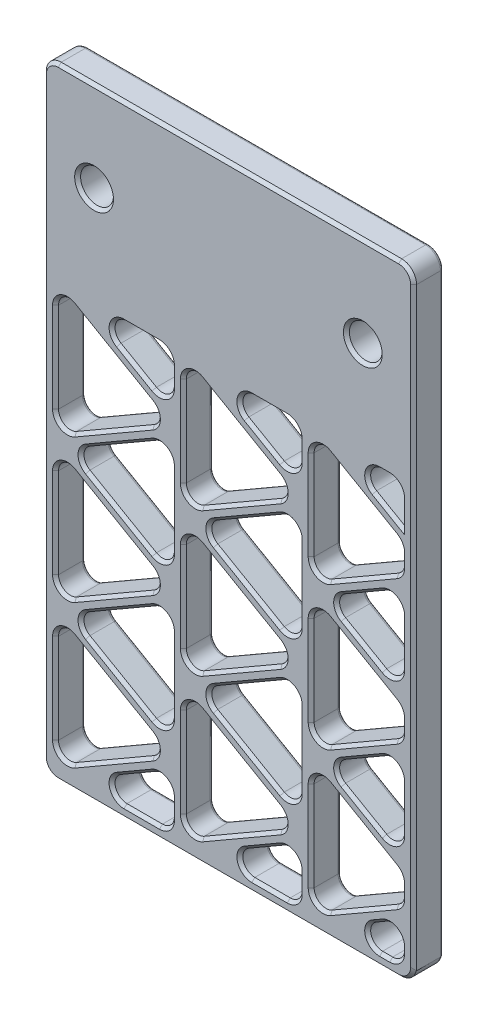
SolidWorks part; units mm, degrees
ref_plane "Płaszczyzna przednia" through (0, 0, 0) normal (0, 0, 1) x (1, 0, 0)
ref_plane "Płaszczyzna górna" through (0, 0, 0) normal (0, 1, 0) x (1, 0, 0)
ref_plane "Płaszczyzna prawa" through (0, 0, 0) normal (1, 0, 0) x (0, 0, -1)
sketch "Szkic1" plane through (0, 0, 0) normal (0, 0, 1) x (1, 0, 0)
  line L1 (0, 0) -> (62, 0)
  line L2 (0, 0) -> (0, 104)
  line L3 (0, 104) -> (62, 104)
  line L4 (62, 0) -> (62, 104)
  dimension "D1" = 62
  dimension "D2" = 104
extrude "Dodanie-wyciągnięcie1" add sketch "Szkic1" along normal blind 5
sketch "Szkic2" plane through (0, 0, 5) normal (0, 0, 1) x (1, 0, 0)
  line L0 (8.5, 89) -> (53.5, 89) construction
  line L1 (31, 89) -> (31, 104) construction
  line L2 (62, 104) -> (0, 104) construction
  dimension "D1" = 45
  dimension "D2" = 15
hole_wizard "Otwór pod śrubę M51" positions "Szkic3" profile "Szkic4" hole size "M5" standard "DIN"
sketch "Szkic3" plane through (0, 0, 5) normal (0, 0, 1) x (1, 0, 0)
  point P0 (8.5, 89)
  point P3 (53.5, 89)
sketch "Szkic4" plane through (8.5, 89, 5) normal (1, 0, 0) x (0, -1, 0)
  line L0 (0, 0) -> (0, 5)
  line L1 (0, 5) -> (2.75, 5)
  line L2 (2.75, 5) -> (2.75, 0)
  line L5 (2.75, 0) -> (0, 0)
  line L11 (0, -6.35) -> (0, 107.95) construction
  dimension "Średnica otworu na wylot" = 5.5
  dimension "Głębokość otworu na wylot" = 5
fillet "Zaokrąglenie1" radius 2.5 4 edges at (62, 0, 2.5) (0, 0, 2.5) (62, 104, 2.5) (0, 104, 2.5)
sketch "Szkic7" plane through (0, 0, 5) normal (0, 0, 1) x (1, 0, 0)
  line L8 (-127.5518, 51.9145) -> (-127.5518, 32.0855)
  line L9 (-88.6374, 71) -> (-108.4663, 71)
  line L10 (-69.5518, 32.0855) -> (-69.5518, 51.9145)
  line L11 (-108.4663, 13) -> (-88.6374, 13)
  line L14 (-125.7, 3.299) -> (-112.9955, 10.634)
  line L15 (-129.45, 14.4636) -> (-129.45, 5.4641)
  line L16 (-113.4955, 12.5) -> (-123.0518, 12.5)
  line L18 (-66.25, 18.5729) -> (-66.25, 31.4271)
  line L19 (-69.0518, 32.7547) -> (-69.0518, 17.5)
  line L24 (-104.3, 3.299) -> (-91.5955, 10.634)
  line L25 (-108.05, 11.5) -> (-108.05, 5.4641)
  line L26 (-92.0955, 12.5) -> (-107.05, 12.5)
  line L30 (-82.9, 3.299) -> (-69.8474, 10.8349)
  line L31 (-86.65, 11.5) -> (-86.65, 5.4641)
  line L32 (-74.0518, 12.5) -> (-85.65, 12.5)
  line L34 (-66.25, 42.5729) -> (-66.25, 55.4271)
  line L35 (-69.0518, 56.7547) -> (-69.0518, 41.2453)
  line L40 (-66.25, 66.5729) -> (-66.25, 70)
  line L41 (-69.0518, 66.5) -> (-69.0518, 65.2453)
  line L42 (-68.75, 72.5) -> (-70.7352, 72.5)
  line L46 (-47.35, 72.5) -> (-53.2859, 72.5)
  line L47 (-44.85, 66.5729) -> (-44.85, 70)
  line L48 (-54.5359, 67.8349) -> (-48.6, 64.4078)
  line L52 (-66.25, 4) -> (-66.25, 7.4271)
  line L53 (-74.6859, 1.5) -> (-68.75, 1.5)
  line L54 (-70, 9.5922) -> (-75.9359, 6.1651)
  line L58 (-25.95, 72.5) -> (-31.8859, 72.5)
  line L59 (-23.45, 66.5729) -> (-23.45, 70)
  line L60 (-33.1359, 67.8349) -> (-27.2, 64.4078)
  line L64 (-44.85, 4) -> (-44.85, 7.4271)
  line L65 (-53.2859, 1.5) -> (-47.35, 1.5)
  line L66 (-48.6, 9.5922) -> (-54.5359, 6.1651)
  line L70 (-48.6, 33.5922) -> (-59.7321, 27.1651)
  line L71 (-44.85, 18.5729) -> (-44.85, 31.4271)
  line L72 (-59.7321, 22.8349) -> (-48.6, 16.4078)
  line L76 (-44.85, 42.5729) -> (-44.85, 55.4271)
  line L77 (-59.7321, 46.8349) -> (-48.6, 40.4078)
  line L78 (-48.6, 57.5922) -> (-59.7321, 51.1651)
  line L82 (-109.05, 4) -> (-109.05, 7.4271)
  line L83 (-117.4859, 1.5) -> (-111.55, 1.5)
  line L84 (-112.8, 9.5922) -> (-118.7359, 6.1651)
  line L88 (-87.65, 4) -> (-87.65, 7.4271)
  line L89 (-96.0859, 1.5) -> (-90.15, 1.5)
  line L90 (-91.4, 9.5922) -> (-97.3359, 6.1651)
  line L94 (-2.05, 4) -> (-2.05, 7.4271)
  line L95 (-10.4859, 1.5) -> (-4.55, 1.5)
  line L96 (-5.8, 9.5922) -> (-11.7359, 6.1651)
  line L100 (-5.8, 33.5922) -> (-16.9321, 27.1651)
  line L101 (-2.05, 18.5729) -> (-2.05, 31.4271)
  line L102 (-16.9321, 22.8349) -> (-5.8, 16.4078)
  line L106 (-2.05, 42.5729) -> (-2.05, 55.4271)
  line L107 (-16.9321, 46.8349) -> (-5.8, 40.4078)
  line L108 (-5.8, 57.5922) -> (-16.9321, 51.1651)
  line L112 (-23.45, 42.5729) -> (-23.45, 55.4271)
  line L113 (-38.3321, 46.8349) -> (-27.2, 40.4078)
  line L114 (-27.2, 57.5922) -> (-38.3321, 51.1651)
  line L118 (-27.2, 33.5922) -> (-38.3321, 27.1651)
  line L119 (-23.45, 18.5729) -> (-23.45, 31.4271)
  line L120 (-38.3321, 22.8349) -> (-27.2, 16.4078)
  line L124 (-23.45, 4) -> (-23.45, 7.4271)
  line L125 (-31.8859, 1.5) -> (-25.95, 1.5)
  line L126 (-27.2, 9.5922) -> (-33.1359, 6.1651)
  line L130 (-4.55, 72.5) -> (-10.4859, 72.5)
  line L131 (-2.05, 66.5729) -> (-2.05, 70)
  line L132 (-11.7359, 67.8349) -> (-5.8, 64.4078)
  line L136 (-18.7, 27.299) -> (-5.6474, 34.8349)
  line L137 (-22.45, 44.5359) -> (-22.45, 29.4641)
  line L138 (-5.6474, 39.1651) -> (-18.7, 46.701)
  line L142 (-18.7, 51.299) -> (-5.6474, 58.8349)
  line L143 (-22.45, 68.5359) -> (-22.45, 53.4641)
  line L144 (-5.6474, 63.1651) -> (-18.7, 70.701)
  line L148 (-40.1, 3.299) -> (-27.0474, 10.8349)
  line L149 (-43.85, 20.5359) -> (-43.85, 5.4641)
  line L150 (-27.0474, 15.1651) -> (-40.1, 22.701)
  line L154 (-40.1, 27.299) -> (-27.0474, 34.8349)
  line L155 (-43.85, 44.5359) -> (-43.85, 29.4641)
  line L156 (-27.0474, 39.1651) -> (-40.1, 46.701)
  line L160 (-61.5, 51.299) -> (-48.4474, 58.8349)
  line L161 (-65.25, 68.5359) -> (-65.25, 53.4641)
  line L162 (-48.4474, 63.1651) -> (-61.5, 70.701)
  line L166 (-61.5, 27.299) -> (-48.4474, 34.8349)
  line L167 (-65.25, 44.5359) -> (-65.25, 29.4641)
  line L168 (-48.4474, 39.1651) -> (-61.5, 46.701)
  line L172 (-61.5, 3.299) -> (-48.4474, 10.8349)
  line L173 (-65.25, 20.5359) -> (-65.25, 5.4641)
  line L174 (-48.4474, 15.1651) -> (-61.5, 22.701)
  line L178 (-40.1, 51.299) -> (-27.0474, 58.8349)
  line L179 (-43.85, 68.5359) -> (-43.85, 53.4641)
  line L180 (-27.0474, 63.1651) -> (-40.1, 70.701)
  line L184 (-18.7, 3.299) -> (-5.6474, 10.8349)
  line L185 (-22.45, 20.5359) -> (-22.45, 5.4641)
  line L186 (-5.6474, 15.1651) -> (-18.7, 22.701)
  line L196 (-38.15, 109.8431) -> (-30.95, 105.6862)
  line L197 (-38.15, 118.1569) -> (-38.15, 109.8431)
  line L198 (-30.95, 122.3138) -> (-38.15, 118.1569)
  line L199 (-23.75, 118.1569) -> (-30.95, 122.3138)
  line L200 (-23.75, 109.8431) -> (-23.75, 118.1569)
  line L201 (-30.95, 105.6862) -> (-23.75, 109.8431)
  circle A2 centre (-123.5518, 67) radius 2.75
  circle A4 centre (-73.5518, 67) radius 2.75
  circle A6 centre (-123.5518, 17) radius 2.75
  circle A8 centre (-73.5518, 17) radius 2.75
  arc A28 (-129.45, 5.4641) -> (-125.7, 3.299) centre (-126.95, 5.4641) ccw
  arc A29 (-127.6063, 15.0004) -> (-129.45, 14.4636) centre (-128.45, 14.4636) ccw
  arc A30 (-127.6063, 15.0004) -> (-123.0518, 12.5) centre (-123.0518, 17.8982) ccw
  arc A31 (-112.9955, 10.634) -> (-113.4955, 12.5) centre (-113.4955, 11.5) ccw
  arc A32 (-127.4945, 52.2482) -> (-127.5518, 51.9145) centre (-126.5518, 51.9145) ccw
  arc A33 (-108.8001, 70.9427) -> (-127.4945, 52.2482) centre (-98.5518, 42) ccw
  arc A34 (-108.4663, 71) -> (-108.8001, 70.9427) centre (-108.4663, 70) ccw
  arc A35 (-88.3036, 70.9427) -> (-88.6374, 71) centre (-88.6374, 70) ccw
  arc A36 (-69.6092, 52.2482) -> (-88.3036, 70.9427) centre (-98.5518, 42) ccw
  arc A37 (-69.5518, 51.9145) -> (-69.6092, 52.2482) centre (-70.5518, 51.9145) ccw
  arc A38 (-69.6092, 31.7518) -> (-69.5518, 32.0855) centre (-70.5518, 32.0855) ccw
  arc A39 (-88.3036, 13.0573) -> (-69.6092, 31.7518) centre (-98.5518, 42) ccw
  arc A40 (-88.6374, 13) -> (-88.3036, 13.0573) centre (-88.6374, 14) ccw
  arc A41 (-108.8001, 13.0573) -> (-108.4663, 13) centre (-108.4663, 14) ccw
  arc A42 (-127.4945, 31.7518) -> (-108.8001, 13.0573) centre (-98.5518, 42) ccw
  arc A43 (-127.5518, 32.0855) -> (-127.4945, 31.7518) centre (-126.5518, 32.0855) ccw
  arc A50 (-66.25, 31.4271) -> (-67.5864, 33.6398) centre (-68.75, 31.4271) ccw
  arc A51 (-67.5956, 16.3554) -> (-66.25, 18.5729) centre (-68.75, 18.5729) ccw
  arc A52 (-69.0564, 17.2853) -> (-67.5956, 16.3554) centre (-68.0574, 17.2424) ccw
  arc A53 (-69.0564, 17.2853) -> (-69.0518, 17.5) centre (-74.0518, 17.5) ccw
  arc A54 (-67.5864, 33.6398) -> (-69.0518, 32.7547) centre (-68.0518, 32.7547) ccw
  arc A56 (-108.05, 5.4641) -> (-104.3, 3.299) centre (-105.55, 5.4641) ccw
  arc A57 (-107.05, 12.5) -> (-108.05, 11.5) centre (-107.05, 11.5) ccw
  arc A58 (-91.5955, 10.634) -> (-92.0955, 12.5) centre (-92.0955, 11.5) ccw
  arc A66 (-86.65, 5.4641) -> (-82.9, 3.299) centre (-84.15, 5.4641) ccw
  arc A67 (-85.65, 12.5) -> (-86.65, 11.5) centre (-85.65, 11.5) ccw
  arc A68 (-74.0518, 12.5) -> (-70.3889, 14.0967) centre (-74.0518, 17.5) ccw
  arc A69 (-68.6955, 13.6933) -> (-70.3889, 14.0967) centre (-69.6563, 13.416) ccw
  arc A70 (-69.8474, 10.8349) -> (-68.6955, 13.6933) centre (-71.0974, 13) ccw
  arc A74 (-66.25, 55.4271) -> (-67.5864, 57.6398) centre (-68.75, 55.4271) ccw
  arc A75 (-67.5864, 40.3602) -> (-66.25, 42.5729) centre (-68.75, 42.5729) ccw
  arc A76 (-69.0518, 41.2453) -> (-67.5864, 40.3602) centre (-68.0518, 41.2453) ccw
  arc A77 (-67.5864, 57.6398) -> (-69.0518, 56.7547) centre (-68.0518, 56.7547) ccw
  arc A84 (-66.25, 70) -> (-68.75, 72.5) centre (-68.75, 70) ccw
  arc A85 (-67.5864, 64.3602) -> (-66.25, 66.5729) centre (-68.75, 66.5729) ccw
  arc A86 (-69.0518, 65.2453) -> (-67.5864, 64.3602) centre (-68.0518, 65.2453) ccw
  arc A87 (-69.0518, 66.5) -> (-71.288, 70.6667) centre (-74.0518, 66.5) ccw
  arc A88 (-70.7352, 72.5) -> (-71.288, 70.6667) centre (-70.7352, 71.5) ccw
  arc A90 (-44.85, 70) -> (-47.35, 72.5) centre (-47.35, 70) ccw
  arc A91 (-48.6, 64.4078) -> (-44.85, 66.5729) centre (-47.35, 66.5729) ccw
  arc A92 (-53.2859, 72.5) -> (-54.5359, 67.8349) centre (-53.2859, 70) ccw
  arc A96 (-68.75, 1.5) -> (-66.25, 4) centre (-68.75, 4) ccw
  arc A97 (-75.9359, 6.1651) -> (-74.6859, 1.5) centre (-74.6859, 4) ccw
  arc A98 (-66.25, 7.4271) -> (-70, 9.5922) centre (-68.75, 7.4271) ccw
  arc A102 (-23.45, 70) -> (-25.95, 72.5) centre (-25.95, 70) ccw
  arc A103 (-27.2, 64.4078) -> (-23.45, 66.5729) centre (-25.95, 66.5729) ccw
  arc A104 (-31.8859, 72.5) -> (-33.1359, 67.8349) centre (-31.8859, 70) ccw
  arc A108 (-47.35, 1.5) -> (-44.85, 4) centre (-47.35, 4) ccw
  arc A109 (-54.5359, 6.1651) -> (-53.2859, 1.5) centre (-53.2859, 4) ccw
  arc A110 (-44.85, 7.4271) -> (-48.6, 9.5922) centre (-47.35, 7.4271) ccw
  arc A114 (-44.85, 31.4271) -> (-48.6, 33.5922) centre (-47.35, 31.4271) ccw
  arc A115 (-48.6, 16.4078) -> (-44.85, 18.5729) centre (-47.35, 18.5729) ccw
  arc A116 (-59.7321, 27.1651) -> (-59.7321, 22.8349) centre (-58.4821, 25) ccw
  arc A120 (-48.6, 40.4078) -> (-44.85, 42.5729) centre (-47.35, 42.5729) ccw
  arc A121 (-59.7321, 51.1651) -> (-59.7321, 46.8349) centre (-58.4821, 49) ccw
  arc A122 (-44.85, 55.4271) -> (-48.6, 57.5922) centre (-47.35, 55.4271) ccw
  arc A126 (-111.55, 1.5) -> (-109.05, 4) centre (-111.55, 4) ccw
  arc A127 (-118.7359, 6.1651) -> (-117.4859, 1.5) centre (-117.4859, 4) ccw
  arc A128 (-109.05, 7.4271) -> (-112.8, 9.5922) centre (-111.55, 7.4271) ccw
  arc A132 (-90.15, 1.5) -> (-87.65, 4) centre (-90.15, 4) ccw
  arc A133 (-97.3359, 6.1651) -> (-96.0859, 1.5) centre (-96.0859, 4) ccw
  arc A134 (-87.65, 7.4271) -> (-91.4, 9.5922) centre (-90.15, 7.4271) ccw
  arc A138 (-4.55, 1.5) -> (-2.05, 4) centre (-4.55, 4) ccw
  arc A139 (-11.7359, 6.1651) -> (-10.4859, 1.5) centre (-10.4859, 4) ccw
  arc A140 (-2.05, 7.4271) -> (-5.8, 9.5922) centre (-4.55, 7.4271) ccw
  arc A144 (-2.05, 31.4271) -> (-5.8, 33.5922) centre (-4.55, 31.4271) ccw
  arc A145 (-5.8, 16.4078) -> (-2.05, 18.5729) centre (-4.55, 18.5729) ccw
  arc A146 (-16.9321, 27.1651) -> (-16.9321, 22.8349) centre (-15.6821, 25) ccw
  arc A150 (-5.8, 40.4078) -> (-2.05, 42.5729) centre (-4.55, 42.5729) ccw
  arc A151 (-16.9321, 51.1651) -> (-16.9321, 46.8349) centre (-15.6821, 49) ccw
  arc A152 (-2.05, 55.4271) -> (-5.8, 57.5922) centre (-4.55, 55.4271) ccw
  arc A156 (-27.2, 40.4078) -> (-23.45, 42.5729) centre (-25.95, 42.5729) ccw
  arc A157 (-38.3321, 51.1651) -> (-38.3321, 46.8349) centre (-37.0821, 49) ccw
  arc A158 (-23.45, 55.4271) -> (-27.2, 57.5922) centre (-25.95, 55.4271) ccw
  arc A162 (-23.45, 31.4271) -> (-27.2, 33.5922) centre (-25.95, 31.4271) ccw
  arc A163 (-27.2, 16.4078) -> (-23.45, 18.5729) centre (-25.95, 18.5729) ccw
  arc A164 (-38.3321, 27.1651) -> (-38.3321, 22.8349) centre (-37.0821, 25) ccw
  arc A168 (-25.95, 1.5) -> (-23.45, 4) centre (-25.95, 4) ccw
  arc A169 (-33.1359, 6.1651) -> (-31.8859, 1.5) centre (-31.8859, 4) ccw
  arc A170 (-23.45, 7.4271) -> (-27.2, 9.5922) centre (-25.95, 7.4271) ccw
  arc A174 (-2.05, 70) -> (-4.55, 72.5) centre (-4.55, 70) ccw
  arc A175 (-5.8, 64.4078) -> (-2.05, 66.5729) centre (-4.55, 66.5729) ccw
  arc A176 (-10.4859, 72.5) -> (-11.7359, 67.8349) centre (-10.4859, 70) ccw
  arc A180 (-22.45, 29.4641) -> (-18.7, 27.299) centre (-19.95, 29.4641) ccw
  arc A181 (-18.7, 46.701) -> (-22.45, 44.5359) centre (-19.95, 44.5359) ccw
  arc A182 (-5.6474, 34.8349) -> (-5.6474, 39.1651) centre (-6.8974, 37) ccw
  arc A186 (-22.45, 53.4641) -> (-18.7, 51.299) centre (-19.95, 53.4641) ccw
  arc A187 (-18.7, 70.701) -> (-22.45, 68.5359) centre (-19.95, 68.5359) ccw
  arc A188 (-5.6474, 58.8349) -> (-5.6474, 63.1651) centre (-6.8974, 61) ccw
  arc A192 (-43.85, 5.4641) -> (-40.1, 3.299) centre (-41.35, 5.4641) ccw
  arc A193 (-40.1, 22.701) -> (-43.85, 20.5359) centre (-41.35, 20.5359) ccw
  arc A194 (-27.0474, 10.8349) -> (-27.0474, 15.1651) centre (-28.2974, 13) ccw
  arc A198 (-43.85, 29.4641) -> (-40.1, 27.299) centre (-41.35, 29.4641) ccw
  arc A199 (-40.1, 46.701) -> (-43.85, 44.5359) centre (-41.35, 44.5359) ccw
  arc A200 (-27.0474, 34.8349) -> (-27.0474, 39.1651) centre (-28.2974, 37) ccw
  arc A204 (-65.25, 53.4641) -> (-61.5, 51.299) centre (-62.75, 53.4641) ccw
  arc A205 (-61.5, 70.701) -> (-65.25, 68.5359) centre (-62.75, 68.5359) ccw
  arc A206 (-48.4474, 58.8349) -> (-48.4474, 63.1651) centre (-49.6974, 61) ccw
  arc A210 (-65.25, 29.4641) -> (-61.5, 27.299) centre (-62.75, 29.4641) ccw
  arc A211 (-61.5, 46.701) -> (-65.25, 44.5359) centre (-62.75, 44.5359) ccw
  arc A212 (-48.4474, 34.8349) -> (-48.4474, 39.1651) centre (-49.6974, 37) ccw
  arc A216 (-65.25, 5.4641) -> (-61.5, 3.299) centre (-62.75, 5.4641) ccw
  arc A217 (-61.5, 22.701) -> (-65.25, 20.5359) centre (-62.75, 20.5359) ccw
  arc A218 (-48.4474, 10.8349) -> (-48.4474, 15.1651) centre (-49.6974, 13) ccw
  arc A222 (-43.85, 53.4641) -> (-40.1, 51.299) centre (-41.35, 53.4641) ccw
  arc A223 (-40.1, 70.701) -> (-43.85, 68.5359) centre (-41.35, 68.5359) ccw
  arc A224 (-27.0474, 58.8349) -> (-27.0474, 63.1651) centre (-28.2974, 61) ccw
  circle A227 centre (-120.95, 89) radius 3.2
  arc A228 (-22.45, 5.4641) -> (-18.7, 3.299) centre (-19.95, 5.4641) ccw
  arc A229 (-18.7, 22.701) -> (-22.45, 20.5359) centre (-19.95, 20.5359) ccw
  arc A230 (-5.6474, 10.8349) -> (-5.6474, 15.1651) centre (-6.8974, 13) ccw
  circle A232 centre (-50.95, 89) radius 3.25
  circle A234 centre (-10.95, 89) radius 3.25
sketch "Szkic8" plane through (0, 0, 5) normal (0, 0, 1) x (1, 0, 0)
  line L0 (-17.95, 72) -> (-2.55, 72) construction
  line L1 (-2.55, 72) -> (-2.55, 63.1088) construction
  line L2 (-2.55, 63.1088) -> (-17.95, 72) construction
  line L3 (-4.55, 72.5) -> (-10.4859, 72.5) construction
  line L4 (-2.05, 66.5729) -> (-2.05, 70) construction
  line L5 (-11.7359, 67.8349) -> (-5.8, 64.4078) construction
  line L6 (-21.95, 72) -> (-21.95, 50) construction
  line L7 (-21.95, 50) -> (-2.8974, 61) construction
  line L8 (-2.8974, 61) -> (-21.95, 72) construction
  line L9 (-2.55, 58.8912) -> (-19.6821, 49) construction
  line L10 (-19.6821, 49) -> (-2.55, 39.1088) construction
  line L11 (-2.55, 39.1088) -> (-2.55, 58.8912) construction
  line L12 (-21.95, 48) -> (-21.95, 26) construction
  line L13 (-21.95, 26) -> (-2.8974, 37) construction
  line L14 (-2.8974, 37) -> (-21.95, 48) construction
  line L15 (-19.6821, 25) -> (-2.55, 34.8912) construction
  line L16 (-2.55, 34.8912) -> (-2.55, 15.1088) construction
  line L17 (-2.55, 15.1088) -> (-19.6821, 25) construction
  line L18 (-21.95, 24) -> (-21.95, 2) construction
  line L19 (-21.95, 2) -> (-2.8974, 13) construction
  line L20 (-2.8974, 13) -> (-21.95, 24) construction
  line L21 (-2.55, 10.8912) -> (-17.95, 2) construction
  line L22 (-17.95, 2) -> (-2.55, 2) construction
  line L23 (-2.55, 2) -> (-2.55, 10.8912) construction
  line L24 (-5.6474, 63.1651) -> (-18.7, 70.701) construction
  line L25 (-18.7, 51.299) -> (-5.6474, 58.8349) construction
  line L26 (-22.45, 68.5359) -> (-22.45, 53.4641) construction
  line L28 (-2.05, 42.5729) -> (-2.05, 55.4271) construction
  line L29 (-5.8, 57.5922) -> (-16.9321, 51.1651) construction
  line L30 (-16.9321, 46.8349) -> (-5.8, 40.4078) construction
  line L31 (-5.6474, 39.1651) -> (-18.7, 46.701) construction
  line L32 (-22.45, 44.5359) -> (-22.45, 29.4641) construction
  line L33 (-18.7, 27.299) -> (-5.6474, 34.8349) construction
  line L34 (-2.05, 18.5729) -> (-2.05, 31.4271) construction
  line L35 (-16.9321, 22.8349) -> (-5.8, 16.4078) construction
  line L36 (-5.6474, 15.1651) -> (-18.7, 22.701) construction
  line L37 (-18.7, 3.299) -> (-5.6474, 10.8349) construction
  line L38 (-5.8, 9.5922) -> (-11.7359, 6.1651) construction
  line L39 (-2.05, 4) -> (-2.05, 7.4271) construction
  line L40 (-10.4859, 1.5) -> (-4.55, 1.5) construction
  line L41 (-5.8, 33.5922) -> (-16.9321, 27.1651) construction
  line L42 (-22.45, 20.5359) -> (-22.45, 5.4641) construction
  line L43 (6.05, 72) -> (21.45, 72)
  line L44 (21.45, 72) -> (21.45, 63.1088)
  line L45 (21.45, 63.1088) -> (6.05, 72)
  line L46 (2.05, 72) -> (2.05, 50)
  line L47 (2.05, 50) -> (21.1026, 61)
  line L48 (21.1026, 61) -> (2.05, 72)
  line L49 (21.45, 58.8912) -> (4.3179, 49)
  line L50 (4.3179, 49) -> (21.45, 39.1088)
  line L51 (21.45, 39.1088) -> (21.45, 58.8912)
  line L52 (2.05, 48) -> (2.05, 26)
  line L53 (2.05, 26) -> (21.1026, 37)
  line L54 (21.1026, 37) -> (2.05, 48)
  line L55 (4.3179, 25) -> (21.45, 34.8912)
  line L56 (21.45, 34.8912) -> (21.45, 15.1088)
  line L57 (21.45, 15.1088) -> (4.3179, 25)
  line L58 (2.05, 24) -> (2.05, 2)
  line L59 (2.05, 2) -> (21.1026, 13)
  line L60 (21.1026, 13) -> (2.05, 24)
  line L61 (21.45, 10.8912) -> (6.05, 2)
  line L62 (6.05, 2) -> (21.45, 2)
  line L63 (21.45, 2) -> (21.45, 10.8912)
  line L64 (27.45, 72) -> (42.85, 72)
  line L65 (42.85, 72) -> (42.85, 63.1088)
  line L66 (42.85, 63.1088) -> (27.45, 72)
  line L67 (23.45, 72) -> (23.45, 50)
  line L68 (23.45, 50) -> (42.5026, 61)
  line L69 (42.5026, 61) -> (23.45, 72)
  line L70 (42.85, 58.8912) -> (25.7179, 49)
  line L71 (25.7179, 49) -> (42.85, 39.1088)
  line L72 (42.85, 39.1088) -> (42.85, 58.8912)
  line L73 (23.45, 48) -> (23.45, 26)
  line L74 (23.45, 26) -> (42.5026, 37)
  line L75 (42.5026, 37) -> (23.45, 48)
  line L76 (25.7179, 25) -> (42.85, 34.8912)
  line L77 (42.85, 34.8912) -> (42.85, 15.1088)
  line L78 (42.85, 15.1088) -> (25.7179, 25)
  line L79 (23.45, 24) -> (23.45, 2)
  line L80 (23.45, 2) -> (42.5026, 13)
  line L81 (42.5026, 13) -> (23.45, 24)
  line L82 (42.85, 10.8912) -> (27.45, 2)
  line L83 (27.45, 2) -> (42.85, 2)
  line L84 (42.85, 2) -> (42.85, 10.8912)
  line L85 (48.85, 72) -> (64.25, 72)
  line L86 (64.25, 72) -> (64.25, 63.1088)
  line L87 (64.25, 63.1088) -> (48.85, 72)
  line L88 (44.85, 72) -> (44.85, 50)
  line L89 (44.85, 50) -> (63.9026, 61)
  line L90 (63.9026, 61) -> (44.85, 72)
  line L91 (64.25, 58.8912) -> (47.1179, 49)
  line L92 (47.1179, 49) -> (64.25, 39.1088)
  line L93 (64.25, 39.1088) -> (64.25, 58.8912)
  line L94 (44.85, 48) -> (44.85, 26)
  line L95 (44.85, 26) -> (63.9026, 37)
  line L96 (63.9026, 37) -> (44.85, 48)
  line L97 (47.1179, 25) -> (64.25, 34.8912)
  line L98 (64.25, 34.8912) -> (64.25, 15.1088)
  line L99 (64.25, 15.1088) -> (47.1179, 25)
  line L100 (44.85, 24) -> (44.85, 2)
  line L101 (44.85, 2) -> (63.9026, 13)
  line L102 (63.9026, 13) -> (44.85, 24)
  line L103 (64.25, 10.8912) -> (48.85, 2)
  line L104 (48.85, 2) -> (64.25, 2)
  line L105 (64.25, 2) -> (64.25, 10.8912)
  dimension "D1" = 0.5
  dimension "D2" = 0.5
  dimension "D3" = 0.5
  dimension "D4" = 0.5
  dimension "D5" = 0.5
  dimension "D6" = 0.5
  dimension "D7" = 0.5
  dimension "D8" = 0.5
  dimension "D9" = 0.5
  dimension "D10" = 0.5
  dimension "D11" = 0.5
  dimension "D12" = 0.5
  dimension "D13" = 0.5
  dimension "D14" = 0.5
  dimension "D15" = 0.5
  dimension "D16" = 0.5
  dimension "D17" = 0.5
  dimension "D18" = 0.5
  dimension "D19" = 0.5
  dimension "D20" = 0.5
  dimension "D21" = 0.5
  dimension "D22" = 2
  dimension "D23" = 3
extrude "Wytnij-wyciągnięcie1" cut sketch "Szkic8" against normal through all
sketch "Szkic9" plane through (0, 0, 5) normal (0, 0, 1) x (1, 0, 0)
  line L0 (48.85, 2) -> (61.9495, 2) construction
  line L1 (62, 72) -> (60, 72)
  line L2 (62, 72) -> (62, 2)
  line L3 (62, 2) -> (60, 2)
  line L4 (60, 72) -> (60, 2)
  dimension "D1" = 2
extrude "Dodanie-wyciągnięcie4" add sketch "Szkic9" against normal blind 5
fillet "Zaokrąglenie2" radius 2 13 edges at (60, 8.4375, 2.5) (21.45, 10.8912, 2.5) (42.85, 10.8912, 2.5) (60, 32.4375, 2.5) (60, 39.2531, 2.5) (42.85, 34.8912, 2.5) (21.45, 34.8912, 2.5) (21.45, 58.8912, 2.5) (42.85, 58.8912, 2.5) (60, 56.4375, 2.5) (60, 72, 2.5) (42.85, 72, 2.5) (21.45, 72, 2.5)
fillet "Zaokrąglenie3" radius 2 9 edges at (2.05, 24, 2.5) (44.85, 24, 2.5) (23.45, 24, 2.5) (44.85, 48, 2.5) (23.45, 48, 2.5) (2.05, 48, 2.5) (44.85, 72, 2.5) (23.45, 72, 2.5) (2.05, 72, 2.5)
fillet "Zaokrąglenie4" radius 2 22 edges at (21.45, 15.1088, 2.5) (21.45, 39.1088, 2.5) (42.85, 39.1088, 2.5) (42.85, 15.1088, 2.5) (60, 17.5625, 2.5) (60, 41.5625, 2.5) (42.85, 63.1088, 2.5) (21.45, 63.1088, 2.5) (21.45, 2, 2.5) (42.85, 2, 2.5) (60, 2, 2.5) (21.1026, 61, 2.5) (42.5026, 61, 2.5) (60, 34.7469, 2.5) (60, 58.7469, 2.5) (42.5026, 37, 2.5) (21.1026, 37, 2.5) (21.1026, 13, 2.5) (42.5026, 13, 2.5) (60, 10.7469, 2.5) (60, 15.2531, 2.5) (60, 63.2531, 2.5)
fillet "Zaokrąglenie5" radius 2 21 edges at (6.05, 2, 2.5) (27.45, 2, 2.5) (48.85, 2, 2.5) (44.85, 2, 2.5) (23.45, 2, 2.5) (2.05, 2, 2.5) (23.45, 26, 2.5) (44.85, 26, 2.5) (2.05, 26, 2.5) (2.05, 50, 2.5) (23.45, 50, 2.5) (44.85, 50, 2.5) (4.3179, 25, 2.5) (47.1179, 25, 2.5) (25.7179, 25, 2.5) (4.3179, 49, 2.5) (25.7179, 49, 2.5) (47.1179, 49, 2.5) (48.85, 72, 2.5) (27.45, 72, 2.5) (6.05, 72, 2.5)
fillet "Zaokrąglenie6" radius 0.5 142 edges at (11.5763, 66.5, 0) (19.1026, 61, 0) (11.5763, 55.5, 0) (3.05, 51.7321, 0) (2.05, 61, 0) (3.05, 70.2679, 0) (56.25, 89, 0) (11.25, 89, 0) (20.8642, 71.4142, 0) (21.45, 68.2865, 0) (20.45, 64.8409, 0) (15.4821, 66.5544, 0) (11.5822, 70.5176, 0) (16.4821, 72, 0) (42.2642, 71.4142, 0) (42.85, 68.2865, 0) (41.85, 64.8409, 0) (36.8821, 66.5544, 0) (32.9822, 70.5176, 0) (37.8821, 72, 0) (24.45, 70.2679, 0) (32.9763, 66.5, 0) (40.5026, 61, 0) (32.9763, 55.5, 0) (24.45, 51.7321, 0) (23.45, 61, 0) (3.05, 22.2679, 0) (11.5763, 18.5, 0) (19.1026, 13, 0) (11.5763, 7.5, 0) (3.05, 3.7321, 0) (2.05, 13, 0) (20.45, 9.1591, 0) (21.45, 5.7135, 0) (20.8642, 2.5858, 0) (16.4821, 2, 0) (11.5822, 3.4824, 0) (15.4821, 7.4456, 0) (20.45, 57.1591, 0) (21.45, 49, 0) (20.45, 40.8409, 0) (12.884, 44.0544, 0) (6.3179, 49, 0) (12.884, 53.9456, 0) (20.45, 33.1591, 0) (21.45, 25, 0) (20.45, 16.8409, 0) (12.884, 20.0544, 0) (6.3179, 25, 0) (12.884, 29.9456, 0) (3.05, 46.2679, 0) (11.5763, 42.5, 0) (19.1026, 37, 0) (11.5763, 31.5, 0) (3.05, 27.7321, 0) (2.05, 37, 0) (41.85, 9.1591, 0) (42.85, 5.7135, 0) (42.2642, 2.5858, 0) (37.8821, 2, 0) (32.9822, 3.4824, 0) (36.8821, 7.4456, 0) (24.45, 46.2679, 0) (32.9763, 42.5, 0) (40.5026, 37, 0) (32.9763, 31.5, 0) (24.45, 27.7321, 0) (23.45, 37, 0) (41.85, 57.1591, 0) (42.85, 49, 0) (41.85, 40.8409, 0) (34.284, 44.0544, 0) (27.7179, 49, 0) (34.284, 53.9456, 0) (24.45, 22.2679, 0) (32.9763, 18.5, 0) (40.5026, 13, 0) (32.9763, 7.5, 0) (24.45, 3.7321, 0) (23.45, 13, 0) (41.85, 33.1591, 0) (42.85, 25, 0) (41.85, 16.8409, 0) (34.284, 20.0544, 0) (27.7179, 25, 0) (34.284, 29.9456, 0) (61.2678, 103.2678, 0) (31, 104, 0) (0.7322, 103.2678, 0) (0, 52, 0) (0.7322, 0.7322, 0) (31, 0, 0) (61.0811, 0.5635, 0) (61.9747, 2, 0) (62, 51.75, 0) (59.4142, 2.5858, 0) (57.1571, 2, 0) (54.3822, 3.4824, 0) (56.1571, 6.2187, 0) (59, 6.7054, 0) (60, 4.4867, 0) (59.4142, 71.4142, 0) (60, 67.7813, 0) (57.6571, 66.9152, 0) (54.3822, 70.5176, 0) (57.1571, 72, 0) (45.85, 70.2679, 0) (53.425, 67.0492, 0) (59.7321, 63.0984, 0) (60, 61, 0) (59.7321, 58.9016, 0) (53.425, 54.9508, 0) (45.85, 51.7321, 0) (44.85, 61, 0) (59, 54.7054, 0) (60, 49, 0) (59, 43.2946, 0) (53.559, 45.2813, 0) (49.1179, 49, 0) (53.559, 52.7187, 0) (45.85, 46.2679, 0) (53.425, 43.0492, 0) (59.7321, 39.0984, 0) (60, 37, 0) (59.7321, 34.9016, 0) (53.425, 30.9508, 0) (45.85, 27.7321, 0) (44.85, 37, 0) (59, 30.7054, 0) (60, 25, 0) (59, 19.2946, 0) (53.559, 21.2813, 0) (49.1179, 25, 0) (53.559, 28.7187, 0) (45.85, 22.2679, 0) (53.425, 19.0492, 0) (59.7321, 15.0984, 0) (60, 13, 0) (59.7321, 10.9016, 0) (53.425, 6.9508, 0) (45.85, 3.7321, 0) (44.85, 13, 0)
chamfer "Sfazowanie1" distance 0.5 angle 45 142 edges at (61.0811, 0.5635, 5) (31, 0, 5) (0.7322, 0.7322, 5) (0, 52, 5) (0.7322, 103.2678, 5) (31, 104, 5) (61.2678, 103.2678, 5) (62, 51.75, 5) (61.9747, 2, 5) (56.25, 89, 5) (11.25, 89, 5) (20.8642, 71.4142, 5) (16.4821, 72, 5) (11.5822, 70.5176, 5) (15.4821, 66.5544, 5) (20.45, 64.8409, 5) (21.45, 68.2865, 5) (42.2642, 71.4142, 5) (37.8821, 72, 5) (32.9822, 70.5176, 5) (36.8821, 66.5544, 5) (41.85, 64.8409, 5) (42.85, 68.2865, 5) (24.45, 51.7321, 5) (32.9763, 55.5, 5) (40.5026, 61, 5) (32.9763, 66.5, 5) (24.45, 70.2679, 5) (23.45, 61, 5) (3.05, 3.7321, 5) (11.5763, 7.5, 5) (19.1026, 13, 5) (11.5763, 18.5, 5) (3.05, 22.2679, 5) (2.05, 13, 5) (11.5822, 3.4824, 5) (16.4821, 2, 5) (20.8642, 2.5858, 5) (21.45, 5.7135, 5) (20.45, 9.1591, 5) (15.4821, 7.4456, 5) (6.3179, 49, 5) (12.884, 44.0544, 5) (20.45, 40.8409, 5) (21.45, 49, 5) (20.45, 57.1591, 5) (12.884, 53.9456, 5) (3.05, 51.7321, 5) (11.5763, 55.5, 5) (19.1026, 61, 5) (11.5763, 66.5, 5) (3.05, 70.2679, 5) (2.05, 61, 5) (20.45, 33.1591, 5) (12.884, 29.9456, 5) (6.3179, 25, 5) (12.884, 20.0544, 5) (20.45, 16.8409, 5) (21.45, 25, 5) (3.05, 27.7321, 5) (11.5763, 31.5, 5) (19.1026, 37, 5) (11.5763, 42.5, 5) (3.05, 46.2679, 5) (2.05, 37, 5) (32.9822, 3.4824, 5) (37.8821, 2, 5) (42.2642, 2.5858, 5) (42.85, 5.7135, 5) (41.85, 9.1591, 5) (36.8821, 7.4456, 5) (24.45, 27.7321, 5) (32.9763, 31.5, 5) (40.5026, 37, 5) (32.9763, 42.5, 5) (24.45, 46.2679, 5) (23.45, 37, 5) (27.7179, 49, 5) (34.284, 44.0544, 5) (41.85, 40.8409, 5) (42.85, 49, 5) (41.85, 57.1591, 5) (34.284, 53.9456, 5) (24.45, 3.7321, 5) (32.9763, 7.5, 5) (40.5026, 13, 5) (32.9763, 18.5, 5) (24.45, 22.2679, 5) (23.45, 13, 5) (41.85, 33.1591, 5) (34.284, 29.9456, 5) (27.7179, 25, 5) (34.284, 20.0544, 5) (41.85, 16.8409, 5) (42.85, 25, 5) (54.3822, 3.4824, 5) (57.1571, 2, 5) (59.4142, 2.5858, 5) (60, 4.4867, 5) (59, 6.7054, 5) (56.1571, 6.2187, 5) (54.3822, 70.5176, 5) (57.6571, 66.9152, 5) (60, 67.7813, 5) (59.4142, 71.4142, 5) (57.1571, 72, 5) (45.85, 70.2679, 5) (44.85, 61, 5) (45.85, 51.7321, 5) (53.425, 54.9508, 5) (59.7321, 58.9016, 5) (60, 61, 5) (59.7321, 63.0984, 5) (53.425, 67.0492, 5) (49.1179, 49, 5) (53.559, 45.2813, 5) (59, 43.2946, 5) (60, 49, 5) (59, 54.7054, 5) (53.559, 52.7187, 5) (45.85, 46.2679, 5) (44.85, 37, 5) (45.85, 27.7321, 5) (53.425, 30.9508, 5) (59.7321, 34.9016, 5) (60, 37, 5) (59.7321, 39.0984, 5) (53.425, 43.0492, 5) (49.1179, 25, 5) (53.559, 21.2813, 5) (59, 19.2946, 5) (60, 25, 5) (59, 30.7054, 5) (53.559, 28.7187, 5) (45.85, 22.2679, 5) (44.85, 13, 5) (45.85, 3.7321, 5) (53.425, 6.9508, 5) (59.7321, 10.9016, 5) (60, 13, 5) (59.7321, 15.0984, 5) (53.425, 19.0492, 5)
